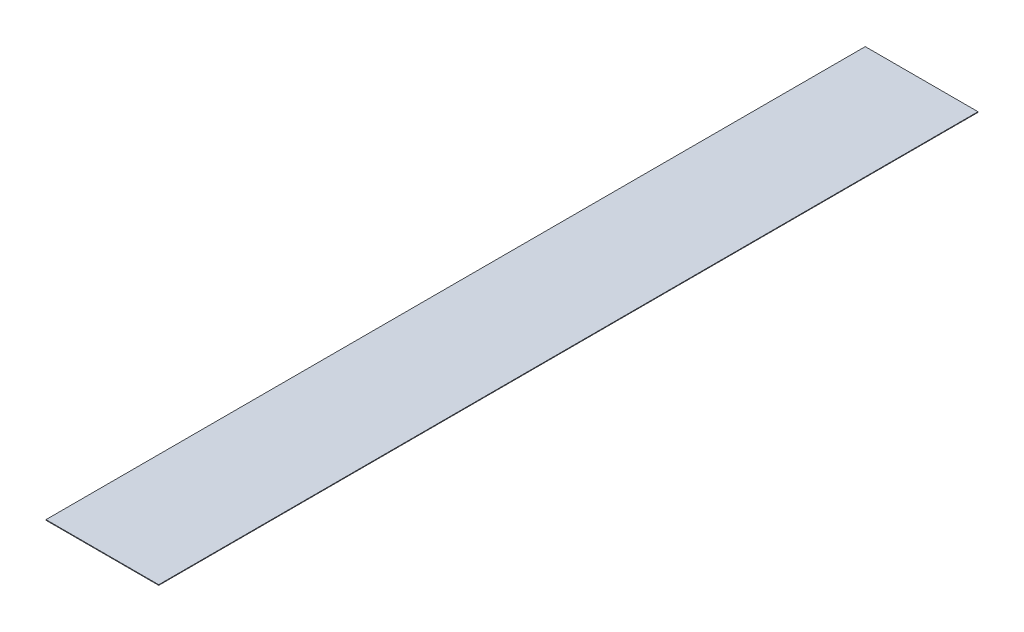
SolidWorks part; units mm, degrees
ref_plane "Front Plane" through (0, 0, 0) normal (0, 0, 1) x (1, 0, 0)
ref_plane "Top Plane" through (0, 0, 0) normal (0, 1, 0) x (1, 0, 0)
ref_plane "Right Plane" through (0, 0, 0) normal (1, 0, 0) x (0, 0, -1)
sketch "Sketch1" plane through (0, 0, 0) normal (0, 1, 0) x (1, 0, 0)
  line L0 (-47.625, 0) -> (0, 0)
  line L2 (0, 0) -> (0, -346.075)
  line L3 (0, -346.075) -> (-47.625, -346.075)
  line L4 (-47.625, 0) -> (-47.625, -346.075)
  dimension "D1" = 346.075
  dimension "D2" = 47.625
extrude "Boss-Extrude1" add sketch "Sketch1" along normal blind 0.254
